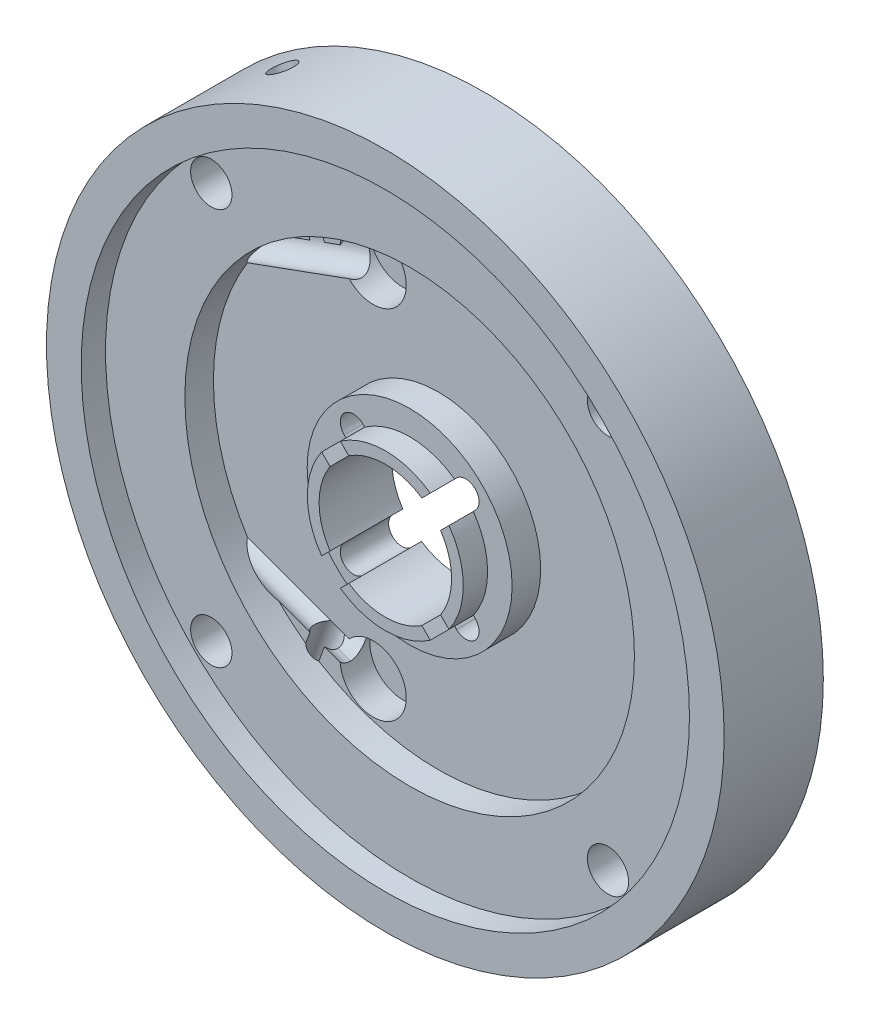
SolidWorks part; units mm, degrees
ref_plane "Front/Back" through (0, 0, 0) normal (0, 0, 1) x (1, 0, 0)
ref_plane "Top/Bottom" through (0, 0, 0) normal (0, 1, 0) x (1, 0, 0)
ref_plane "Right/Left" through (0, 0, 0) normal (1, 0, 0) x (0, 0, -1)
sketch "Sketch1" plane through (0, 0, 0) normal (0, 1, 0) x (1, 0, 0)
  line L0 (0, 0) -> (0, 30.6192) construction
  line L1 (12.7254, 0) -> (12.7254, 13.97)
  line L2 (12.7254, 13.97) -> (25.4, 13.97)
  line L3 (25.4, 13.97) -> (25.4, 19.05)
  line L4 (25.4, 19.05) -> (65.0875, 19.05)
  line L5 (65.0875, 19.05) -> (65.0875, 0)
  line L6 (65.0875, 0) -> (58.42, 0)
  line L7 (58.42, 0) -> (58.42, 4.6736)
  line L8 (58.42, 4.6736) -> (43.18, 4.6736)
  line L9 (43.18, 4.6736) -> (43.18, 10.16)
  line L10 (43.18, 10.16) -> (19.685, 10.16)
  line L11 (19.685, 10.16) -> (19.685, 4.6736)
  line L12 (19.685, 4.6736) -> (14.9746, 4.6736)
  line L13 (14.9746, 4.6736) -> (14.9746, 0)
  line L14 (14.9746, 0) -> (12.7254, 0)
  line L15 (0, 0) -> (86.5244, 0) construction
  dimension "D1" = 50.8
  dimension "D2" = 25.4508
  dimension "D3" = 29.9491
  dimension "D4" = 39.37
  dimension "D5" = 86.36
  dimension "D6" = 116.84
  dimension "D7" = 130.175
  dimension "D8" = 5.08
  dimension "D9" = 10.16
  dimension "D10" = 19.05
  dimension "D11" = 4.6736
revolve "Revolve1" add sketch "Sketch1" angle 360 about L0
hole_wizard "3/8-16 Tapped Hole1" positions "Sketch3" profile "Sketch2" tap size "3/8-16" standard "Ansi Inch"
sketch "Sketch3" plane through (0, 0, -19.05) normal (0, 0, -1) x (-1, 0, 0)
  line L0 (0, 0) -> (30.9843, 0) construction
  line L1 (0, 0) -> (0, 38.1059) construction
  point P0 (-38.1, 38.1)
  point P1 (38.1, 38.1)
  point P2 (38.1, -38.1)
  point P3 (-38.1, -38.1)
  dimension "D1" = 76.2
  dimension "D2" = 76.2
sketch "Sketch2" plane through (38.1, 38.1, -19.05) normal (1, 0, 0) x (0, 1, 0)
  line L0 (0, 0) -> (0, 20.6346)
  line L1 (0, 20.6346) -> (3.9687, 18.2499)
  line L2 (3.9687, 18.2499) -> (3.9687, 0)
  line L5 (3.9687, 0) -> (0, 0)
  line L10 (0, 20.6346) -> (-3.9688, 18.2499) construction
  line L11 (0, -6.35) -> (0, 107.95) construction
  dimension "Tap Drill Dia." = 7.9375
  dimension "Tap Drill Depth" = 18.2499
  dimension "Drill Angle" = 118
sketch "Sketch4" plane through (0, 0, -19.05) normal (0, 0, -1) x (-1, 0, 0)
  line L0 (0, 0) -> (0, 14.5195) construction
  line L1 (0, 0) -> (17.3874, 0) construction
  circle A0 centre (0, 38.1) radius 4.7943
  circle A1 centre (38.1, 0) radius 4.7943
  circle A2 centre (0, -38.1) radius 4.7943
  circle A3 centre (-38.1, 0) radius 4.7943
  dimension "D1" = 9.5885
  dimension "D2" = 76.2
  dimension "D3" = 76.2
extrude "Cut-Extrude1" cut sketch "Sketch4" against normal blind 6.35
sketch "Sketch6" plane through (0, 0, -19.05) normal (0, 0, -1) x (-1, 0, 0)
  line L0 (10.6132, 7.0211) -> (12.5903, 8.9982)
  line L1 (8.9982, 12.5903) -> (7.0211, 10.6132)
  line L2 (0, 0) -> (22.7748, 0) construction
  line L3 (0, 0) -> (0, 18.0127) construction
  line L4 (0, 0) -> (6.4142, 6.4142) construction
  line L5 (0, 0) -> (2.9793, -2.9793) construction
  circle A0 centre (0, 0) radius 12.7254 construction
  arc A1 (10.6132, 7.0211) -> (7.0211, 10.6132) centre (0, 0) ccw
  arc A2 (12.5903, 8.9982) -> (8.9982, 12.5903) centre (10.7943, 10.7943) ccw
  dimension "D3" = 90
  dimension "D4" = 15.2654
  dimension "D1" = 45
  dimension "D2" = 5.08
extrude "Cut-Extrude2" cut sketch "Sketch6" against normal through all
pattern_circular "CirPattern1" count 4 over 360 about axis through (0, 0, 0) along (0, 0, 1) of "Cut-Extrude2"
sketch "Sketch8" plane through (0, 0, 0) normal (0, 0, 1) x (1, 0, 0)
  line L0 (0, 0) -> (-68.2747, 0) construction
  line L1 (0, 0) -> (-61.1622, 22.2612) construction
  line L2 (0, 0) -> (0, -10.0233) construction
  line L3 (0, 0) -> (-22.2612, -61.1622) construction
  line L4 (0, 0) -> (-61.1622, -22.2612) construction
  line L5 (0, 0) -> (-22.2612, 61.1622) construction
  circle A0 centre (0, 0) radius 65.0875 construction
  dimension "D1" = 20
  dimension "D2" = 20
ref_plane "Plane2" through (-61.1622, 22.2612, 0) normal (-0.9397, 0.342, 0) x (-0.342, -0.9397, 0)
ref_plane "Plane3" through (-22.2612, -61.1622, 0) normal (-0.342, -0.9397, 0) x (0.9397, -0.342, 0)
sketch "Sketch9" plane through (0, 0, -19.05) normal (0, 0, -1) x (-1, 0, 0)
  line L0 (0, 0) -> (61.1622, 22.2612) construction
  line L1 (0, 0) -> (22.2612, -61.1622) construction
  line L2 (0, 0) -> (93.9601, 0) construction
  circle A0 centre (12.4924, -34.3225) radius 6.35
  circle A1 centre (12.4924, 34.3225) radius 6.35
  dimension "D2" = 12.7
  dimension "D1" = 36.5252
extrude "Cut-Extrude3" cut sketch "Sketch9" against normal through all
hole_wizard "1/4-28 Tapped Hole1" positions "Sketch13" profile "Sketch12" tap size "1/4-28" standard "Ansi Inch"
sketch "Sketch13" plane through (-61.1622, 22.2612, 0) normal (-0.9397, 0.342, 0) x (-0.342, -0.9397, 0)
  line L0 (0, 0) -> (0, -30.8108) construction
  line L1 (-65.0875, -19.05) -> (65.0875, -19.05) construction
  point P0 (36.5252, -12.065)
  dimension "D1" = 36.5252
  dimension "D2" = 6.985
sketch "Sketch12" plane through (-73.6546, -12.0612, -12.065) normal (0, 0, 1) x (-0.342, -0.9397, 0)
  line L0 (0, 0) -> (0, 58.7375)
  line L1 (0, 58.7375) -> (3.175, 58.7375)
  line L2 (3.175, 58.7375) -> (3.175, 0)
  line L5 (3.175, 0) -> (0, 0)
  line L11 (0, -6.35) -> (0, 107.95) construction
  dimension "Thread Major Dia." = 6.35
  dimension "Thru Tap Drill Depth" = 58.7375
hole_wizard "#10-32 Tapped Hole1" positions "Sketch15" profile "Sketch14" tap size "#10-32" standard "Ansi Inch"
sketch "Sketch15" plane through (-22.2612, -61.1622, 0) normal (-0.342, -0.9397, 0) x (0.9397, -0.342, 0)
  line L0 (-6.35, -19.05) -> (6.35, -19.05) construction
  line L1 (0, 0) -> (0, 20.2182) construction
  point P0 (-10.5156, -12.065)
  dimension "D1" = 6.985
  dimension "D2" = 10.5156
sketch "Sketch14" plane through (-32.1427, -57.5657, -12.065) normal (0, 0, 1) x (0.9397, -0.342, 0)
  line L0 (0, 0) -> (0, 25.3873)
  line L1 (0, 25.3873) -> (2.413, 25.3873)
  line L2 (2.413, 25.3873) -> (2.413, 0)
  line L5 (2.413, 0) -> (0, 0)
  line L11 (0, -6.35) -> (0, 107.95) construction
  dimension "Thread Major Dia." = 4.826
  dimension "Thru Tap Drill Depth" = 25.3873
ref_plane "Plane4" through (-61.1622, -22.2612, 0) normal (-0.9397, -0.342, 0) x (0, 0, 1)
ref_plane "Plane5" through (-22.2612, 61.1622, 0) normal (-0.342, 0.9397, 0) x (-0.9397, -0.342, 0)
hole_wizard "1/4-28 Tapped Hole2" positions "Sketch17" profile "Sketch16" tap size "1/4-28" standard "Ansi Inch"
sketch "Sketch17" plane through (-61.1622, -22.2612, 0) normal (-0.9397, -0.342, 0) x (0, 0, 1)
  line L0 (0, 0) -> (17.8539, 0) construction
  line L1 (-19.05, 65.0875) -> (-19.05, -65.0875) construction
  point P0 (-12.065, 36.5252)
  dimension "D1" = 36.5252
  dimension "D2" = 6.985
sketch "Sketch16" plane through (-73.6546, 12.0612, -12.065) normal (0, 0, 1) x (0.342, -0.9397, 0)
  line L0 (0, 0) -> (0, 58.7375)
  line L1 (0, 58.7375) -> (3.175, 58.7375)
  line L2 (3.175, 58.7375) -> (3.175, 0)
  line L5 (3.175, 0) -> (0, 0)
  line L11 (0, -6.35) -> (0, 107.95) construction
  dimension "Thread Major Dia." = 6.35
  dimension "Thru Tap Drill Depth" = 58.7375
hole_wizard "#10-32 Tapped Hole2" positions "Sketch19" profile "Sketch18" tap size "#10-32" standard "Ansi Inch"
sketch "Sketch19" plane through (-22.2612, 61.1622, 0) normal (-0.342, 0.9397, 0) x (-0.9397, -0.342, 0)
  line L0 (-25.4, -19.05) -> (25.4, -19.05) construction
  line L1 (0, 0) -> (0, 22.4364) construction
  point P0 (10.5156, -12.065)
  dimension "D1" = 6.985
  dimension "D2" = 10.5156
sketch "Sketch18" plane through (-32.1427, 57.5657, -12.065) normal (0, 0, 1) x (-0.9397, -0.342, 0)
  line L0 (0, 0) -> (0, 25.3873)
  line L1 (0, 25.3873) -> (2.413, 25.3873)
  line L2 (2.413, 25.3873) -> (2.413, 0)
  line L5 (2.413, 0) -> (0, 0)
  line L11 (0, -6.35) -> (0, 107.95) construction
  dimension "Thread Major Dia." = 4.826
  dimension "Thru Tap Drill Depth" = 25.3873
sketch "Sketch20" plane through (0, 0, -19.05) normal (0, 0, -1) x (-1, 0, 0)
  circle A0 centre (12.4924, -34.3225) radius 6.35 construction
  circle A1 centre (12.4924, 34.3225) radius 6.35 construction
  circle A2 centre (12.4924, -34.3225) radius 6.35
  circle A3 centre (12.4924, 34.3225) radius 6.35
extrude "Extrude1" add sketch "Sketch20" against normal blind 3.175
